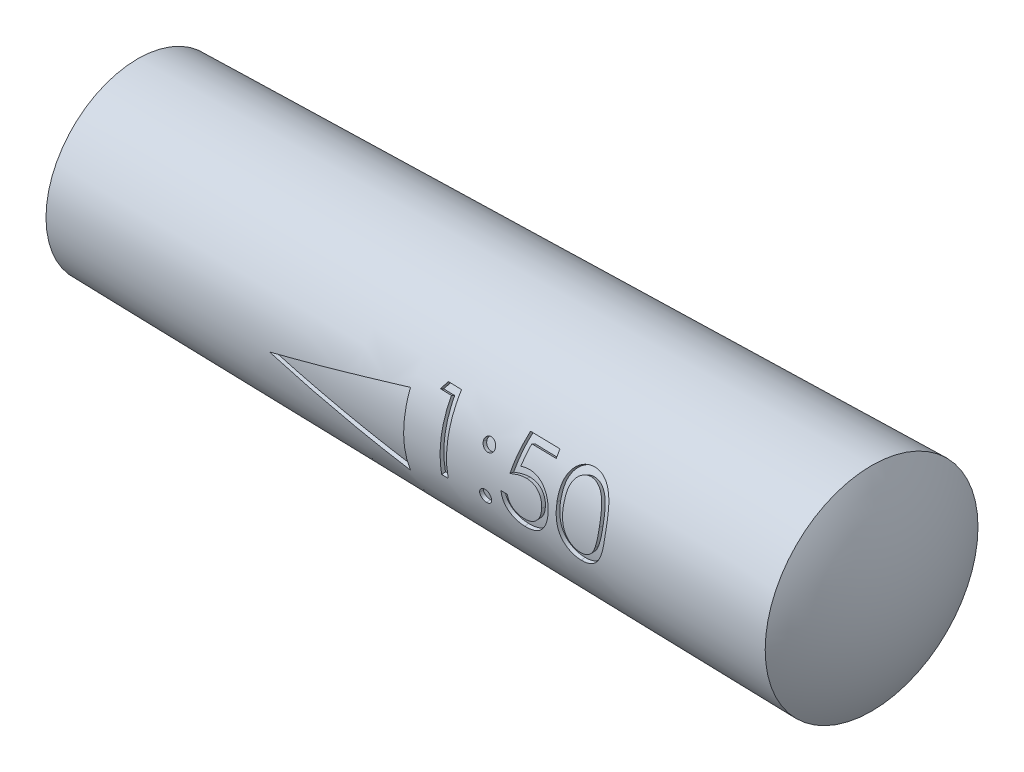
SolidWorks part; units mm, degrees
ref_plane "Front Plane" through (0, 0, 0) normal (0, 0, 1) x (1, 0, 0)
ref_plane "Top Plane" through (0, 0, 0) normal (0, 1, 0) x (1, 0, 0)
ref_plane "Right Plane" through (0, 0, 0) normal (1, 0, 0) x (0, 0, -1)
sketch "Sketch1" plane through (0, 0, 0) normal (1, 0, 0) x (0, 0, -1)
  circle A0 centre (0, 0) radius 1.25
  dimension "D1" = 2.5
extrude "Extrude1" add sketch "Sketch1" along normal mid plane 10
draft "Draft1" type of draft neutral plane draft angle 1.146 faces to draft 1 parameters "D1"=1.146
sketch "Sketch2" plane through (0, 0, 0) normal (0, 0, 1) x (1, 0, 0)
  line L0 (-5, 0) -> (-5, 1.25)
  line L1 (-5, 1.25) -> (-5, -1.25) construction
  line L2 (-5, 0) -> (-5.4, 0)
  line L3 (-5.4, 0) -> (-5.4, -1.35) construction
  line L4 (5, 0) -> (5, 1.45)
  line L5 (5, -1.45) -> (5, 1.45) construction
  line L6 (5, 0) -> (5.4, 0)
  line L7 (5.4, 0) -> (5.4, -1.35) construction
  line L8 (-5, -1.25) -> (5, -1.45) construction
  arc A0 (-5.4, 0) -> (-5, 1.25) centre (-3.2469, 0) cw
  arc A1 (5.4, 0) -> (5, 1.45) centre (2.5719, 0) ccw
  point P14 (0, -1.35)
revolve "Revolve1" add sketch "Sketch2" angle 360 about L2
sketch "Sketch5" plane through (0, 0, 0) normal (0, 0, 1) x (1, 0, 0)
  line L0 (0, 1.35) -> (0, -1.35) construction
  line L1 (5, 1.45) -> (-5, 1.25) construction
  line L2 (-5, -1.25) -> (5, -1.45) construction
ref_plane "Plane2" through (0, 0, 0) normal (-0.02, 0, 0.9998) x (0.9998, 0, 0.02)
sketch "Sketch6" plane through (0, 0, 0) normal (-0.02, 0, 0.9998) x (0.9998, 0, 0.02)
  line L0 (0, 0) -> (0, 0.5)
  line L1 (0, 1.35) -> (0, -1.35) construction
  line L2 (0, 0.5) -> (-1.866, 0)
  line L3 (-1.866, 0) -> (0, -0.5)
  line L4 (0, -0.5) -> (0, 0)
  line L5 (0, -0.25) -> (3, -0.25) construction
  text T0 "1:50" font "Century Gothic" height 1
  dimension "D1" = 1
  dimension "D2" = 30
  dimension "D3" = 3
wrap "Wrap2" sketch "Sketch6" wrap type deboss source sketch "Sketch6" thickness 0.05 parameters "D1"=0.05
equation "\"D2@Sketch2\" = \"D1@Sketch2\""
